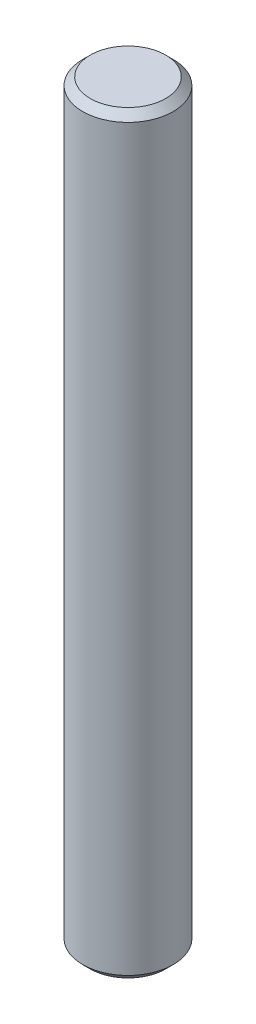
SolidWorks part; units mm, degrees
ref_plane "Front Plane" through (0, 0, 0) normal (0, 0, 1) x (1, 0, 0)
ref_plane "Top Plane" through (0, 0, 0) normal (0, 1, 0) x (1, 0, 0)
ref_plane "Right Plane" through (0, 0, 0) normal (1, 0, 0) x (0, 0, -1)
sketch "Sketch1" plane through (0, 0, 0) normal (0, 1, 0) x (1, 0, 0)
  circle A0 centre (0, 0) radius 1.5
  dimension "D1" = 3
extrude "Boss-Extrude1" add sketch "Sketch1" along normal blind 25
chamfer "Chamfer1" distance 0.25 angle 45 2 edges at (0, 25, 1.5) (0, 0, 1.5)
